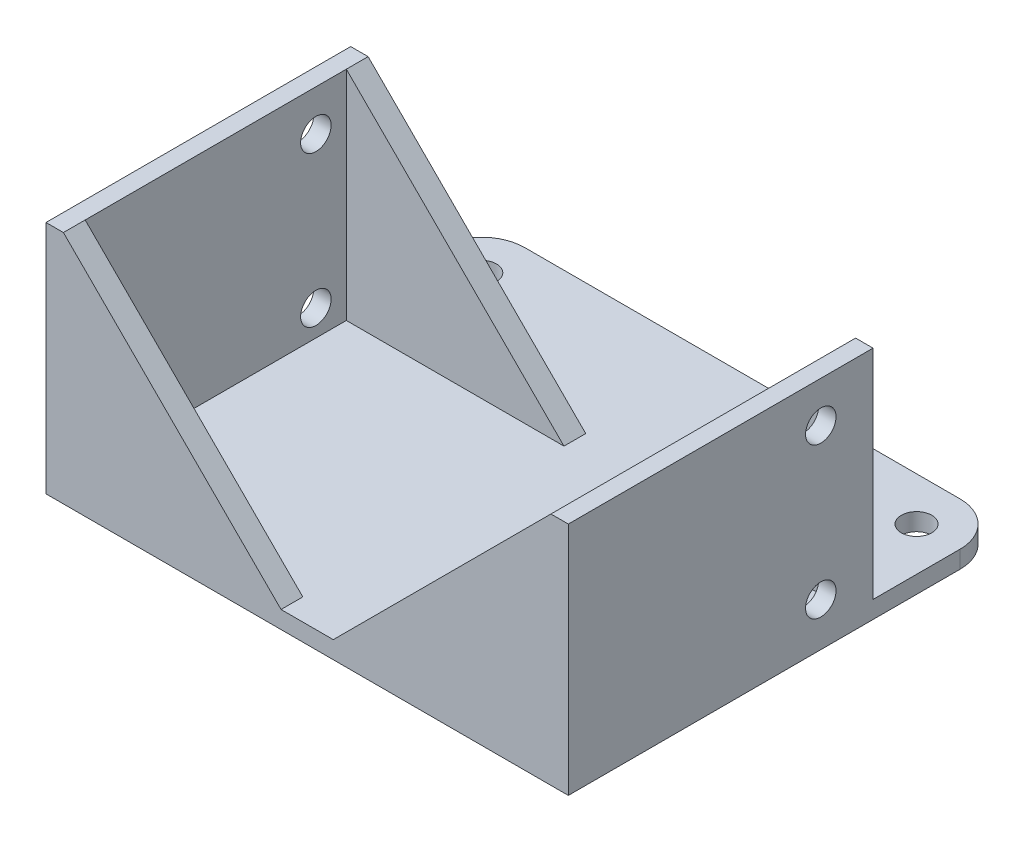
SolidWorks part; units mm, degrees
ref_plane "Front Plane" through (0, 0, 0) normal (0, 0, 1) x (1, 0, 0)
ref_plane "Top Plane" through (0, 0, 0) normal (0, 1, 0) x (1, 0, 0)
ref_plane "Right Plane" through (0, 0, 0) normal (1, 0, 0) x (0, 0, -1)
sketch "Sketch1" plane through (0, 0, 0) normal (0, 1, 0) x (1, 0, 0)
  line L1 (-30, -25) -> (30, -25)
  line L2 (-30, -25) -> (-30, 25)
  line L3 (-30, 25) -> (30, 25)
  line L4 (30, -25) -> (30, 25)
  line L5 (-30, -25) -> (30, 25) construction
  line L6 (-30, 25) -> (30, -25) construction
  point P0 (0, 0)
  dimension "D1" = 60
  dimension "D2" = 50
extrude "Boss-Extrude1" add sketch "Sketch1" along normal blind 2
sketch "Sketch2" plane through (0, 2, 0) normal (0, 1, 0) x (1, 0, 0)
  line L0 (-30, -25) -> (30, -25) construction
  line L1 (-30, -25) -> (-28, -25)
  line L2 (-30, -25) -> (-30, 10)
  line L3 (-30, 10) -> (-28, 10)
  line L4 (-28, -25) -> (-28, 10)
  line L5 (30, -25) -> (28, -25)
  line L6 (30, -25) -> (30, 10)
  line L7 (30, 10) -> (28, 10)
  line L8 (28, -25) -> (28, 10)
  dimension "D1" = 2
  dimension "D2" = 2
  dimension "D3" = 35
  dimension "D4" = 35
extrude "Boss-Extrude2" add sketch "Sketch2" along normal blind 25
sketch "Sketch3" plane through (-30, 0, 0) normal (-1, 0, 0) x (0, 0, 1)
  line L0 (-4, 36.728) -> (-4, -5.4181) construction
  line L1 (25, 13.5) -> (-10, 13.5) construction
  line L2 (25, 27) -> (25, 0) construction
  line L3 (-10, 27) -> (-10, 2) construction
  line L4 (-25, 0) -> (25, 0) construction
  circle A0 centre (-4, 22.3) radius 1.75
  circle A1 centre (-4, 5) radius 1.75
  dimension "D1" = 3.5
  dimension "D2" = 3.5
  dimension "D3" = 17.3
  dimension "D4" = 5
  dimension "D5" = 6
sketch "Sketch4" plane through (0, 0, 25) normal (0, 0, 1) x (1, 0, 0)
  line L0 (-28, 27) -> (-3, 2)
  line L1 (-28, 2) -> (28, 2) construction
  line L2 (28, 27) -> (3, 2)
  line L3 (-28, 27) -> (-30, 27)
  line L4 (-30, 27) -> (-30, 0)
  line L5 (-30, 0) -> (-3, 0)
  line L6 (-30, 0) -> (30, 0) construction
  line L7 (-3, 0) -> (-3, 2)
  line L8 (28, 27) -> (30, 27)
  line L9 (30, 27) -> (30, 0)
  line L10 (30, 0) -> (3, 0)
  line L11 (3, 0) -> (3, 2)
  dimension "D1" = 45
  dimension "D2" = 45
extrude "Boss-Extrude3" add sketch "Sketch4" against normal up to surface (35 mm away)
sketch "Sketch5" plane through (0, 2, 0) normal (0, 1, 0) x (1, 0, 0)
  line L0 (-28, -25) -> (-28, 10) construction
  line L1 (-28, -22.5) -> (28, -22.5)
  line L2 (-28, -22.5) -> (-28, 7.5)
  line L3 (-28, 7.5) -> (28, 7.5)
  line L4 (28, -22.5) -> (28, 7.5)
  line L5 (28, 10) -> (28, -25) construction
  line L6 (-28, 10) -> (-3, 10) construction
  line L7 (-3, -25) -> (-28, -25) construction
  dimension "D1" = 2.5
  dimension "D2" = 2.5
extrude "Cut-Extrude1" cut sketch "Sketch5" along normal blind 31 contours L2 L1 L4 L3
extrude "Cut-Extrude2" cut sketch "Sketch3" against normal through all both and the other way through all
fillet "Fillet1" radius 5 2 edges at (-30, 1, -25) (30, 1, -25)
sketch "Sketch6" plane through (0, 0, 0) normal (0, -1, 0) x (1, 0, 0)
  line L1 (-25, -20) -> (25, -20) construction
  line L2 (-25, -20) -> (-25, 20) construction
  line L3 (-25, 20) -> (25, 20) construction
  line L4 (25, -20) -> (25, 20) construction
  line L5 (-25, -20) -> (25, 20) construction
  line L6 (-25, 20) -> (25, -20) construction
  circle A0 centre (-25, 20) radius 1.75
  circle A1 centre (25, 20) radius 1.75
  circle A2 centre (25, -20) radius 1.75
  circle A3 centre (-25, -20) radius 1.75
  point P0 (0, 0)
  dimension "D3" = 3.5
  dimension "D4" = 3.5
  dimension "D5" = 3.5
  dimension "D6" = 3.5
  dimension "D1" = 50
  dimension "D2" = 40
extrude "Cut-Extrude3" cut sketch "Sketch6" against normal through all both and the other way through all contours A0 | A1 | A2 | A3
